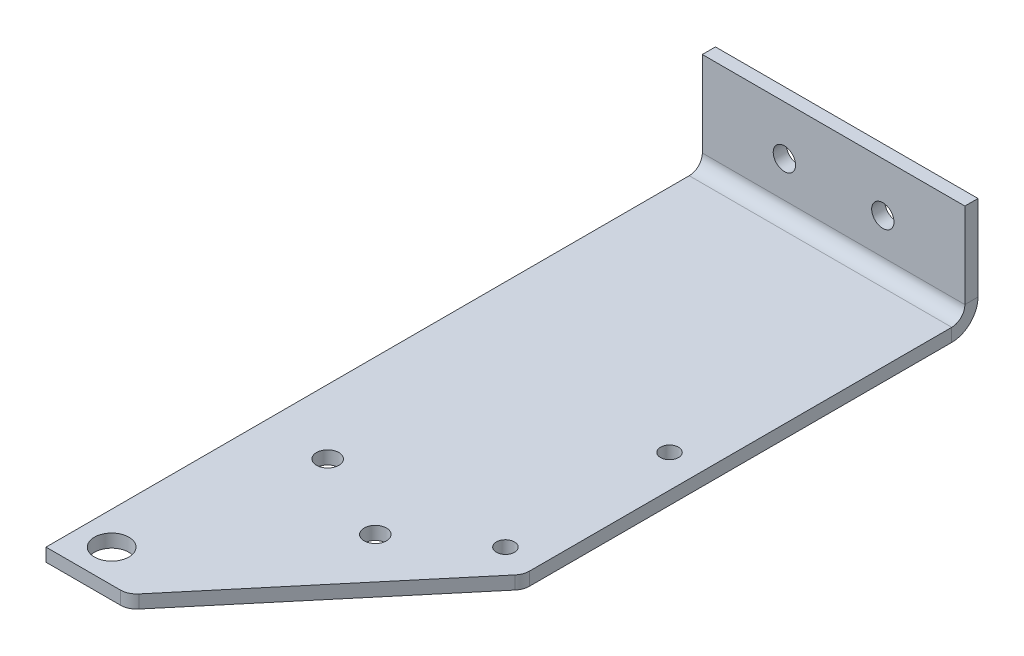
SolidWorks part; units mm, degrees
ref_plane "Plan de face" through (0, 0, 0) normal (0, 0, 1) x (1, 0, 0)
ref_plane "Plan de dessus" through (0, 0, 0) normal (0, 1, 0) x (1, 0, 0)
ref_plane "Plan de droite" through (0, 0, 0) normal (1, 0, 0) x (0, 0, -1)
mirrored part "BD030101_Rendre symétrique"
other "<BD030101>-<Diamètre du perçage M5.5 (5.500000)1>"
